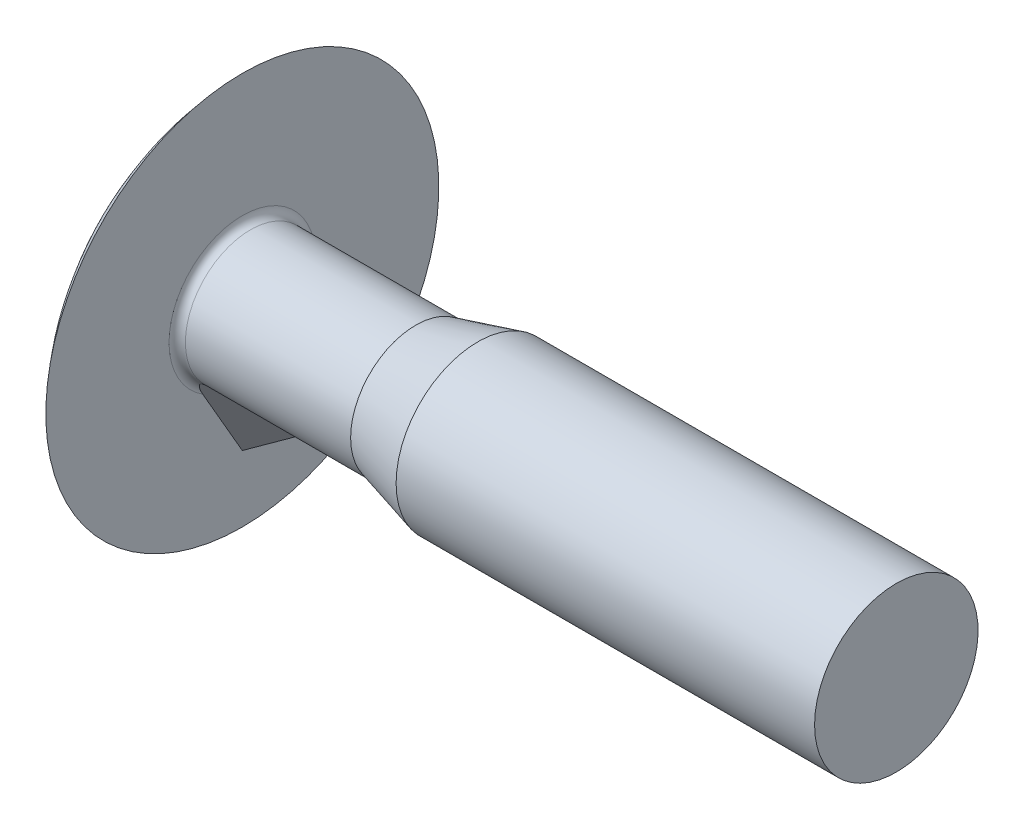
SolidWorks part; units mm, degrees
ref_plane "Front" through (0, 0, 0) normal (0, 0, 1) x (1, 0, 0)
ref_plane "Top" through (0, 0, 0) normal (0, 1, 0) x (1, 0, 0)
ref_plane "Right" through (0, 0, 0) normal (1, 0, 0) x (0, 0, -1)
sketch "Sketch1" plane through (-7.6906, 4.3277, 0) normal (0, 0, 1) x (0, 1, 0)
  line L0 (-4.3277, -12.2906) -> (-16.3461, -12.2906)
  line L1 (-4.3277, 1.3165) -> (-4.3277, -29.2605) construction
  line L2 (-4.3277, -12.2906) -> (-4.3277, -7.6906)
  arc A0 (-4.3277, -7.6906) -> (-16.3461, -12.2906) centre (-4.3277, -25.6906) ccw
  dimension "r" = 18
  dimension "k" = 4.6
revolve "BaseHead" add sketch "Sketch1" angle 360 about L1
sketch "Sketch2" plane through (4.6, 0, 0) normal (1, 0, 0) x (0, 0, -1)
  circle A0 centre (0, 0) radius 5
  dimension "d" = 10
extrude "BaseBody" add sketch "Sketch2" along normal blind 40
sketch "Sketch3" plane through (-15.8544, 0, 20.8544) normal (0, 1, 0) x (0, 0, -1)
  line L0 (20.8544, 6.1636) -> (20.8544, -42.8724) construction
  line L1 (25.8544, -34.8604) -> (24.8362, -31.0604)
  line L2 (20.8544, -60.4544) -> (20.8544, -20.4544) construction
  line L3 (24.8362, -31.0604) -> (24.8362, -20.4544)
  line L4 (25.8544, -60.4544) -> (25.8544, -20.4544) construction
  line L5 (24.8362, -20.4544) -> (25.8544, -20.4544)
  line L6 (25.8544, -20.4544) -> (25.8544, -34.8604)
  line L7 (15.8544, -20.4544) -> (25.8544, -20.4544) construction
  line L8 (8.8361, -20.4544) -> (32.8727, -20.4544) construction
  line L9 (15.8544, -60.4544) -> (25.8544, -60.4544) construction
  dimension "D1" = 15
  dimension "x" = 3.8
revolve "Cut-Revolve1" cut sketch "Sketch3" angle 360 about L0
fillet "Fillet1" radius 0.5 1 edges at (4.6, 0, 3.9818)
ref_plane "Plan1" through (10.1, 0, 0) normal (1, 0, 0) x (0, 0, -1)
sketch "Sketch4" plane through (4.6, 10.7187, 8.8426) normal (1, 0, 0) x (0, 0, 1)
  line L0 (-12.291, 12.7096) -> (-8.8426, 18.6823)
  line L1 (-8.8426, 18.6823) -> (-5.3943, 12.7096)
  line L2 (-12.291, 12.7096) -> (-5.3943, 12.7096)
  circle A0 centre (-8.8426, 10.7187) radius 3.9818 construction
  point P5 (-8.8426, 12.7096)
  dimension "D1" = 60
sketch "Sketch5" plane through (10.1, 0, 0) normal (1, 0, 0) x (0, 0, -1)
  line L0 (0, 0) -> (0, -9.3883) construction
  circle A0 centre (0, 0) radius 3.9818 construction
  circle A1 centre (0, 0) radius 3.9818 construction
  point P6 (0, -3.9818)
loft "Nib" add profiles "Sketch4", "Sketch5"
sketch "Sketch6" plane through (0, 0, 0) normal (0, 0, 1) x (1, 0, 0)
  line L0 (44.194, 5.2) -> (45.006, 5.2)
  line L1 (45.006, 5.2) -> (45.006, 5)
  line L2 (45.006, 5) -> (44.6, 4.2968)
  line L3 (44.194, 5) -> (44.6, 4.2968)
  line L4 (44.194, 5.2) -> (44.194, 5)
  line L5 (44.6, -5) -> (44.6, 5) construction
  line L6 (44.194, 5) -> (45.006, 5) construction
  line L7 (44.6, 5) -> (44.6, 4.2968) construction
  line L8 (44.6, 5) -> (19.006, 5) construction
  line L9 (0, 0) -> (56.0764, 0) construction
  point P5 (44.6, 5.2)
  dimension "D1" = 0.2
  dimension "D2" = 0.812
revolve "Cut-Revolve10" [suppressed] cut sketch "Sketch6" angle 360 about L9
pattern_linear "LPattern10" [suppressed] count 26 spacing 0.9744 along (1, 0, 0)
equation "\"D2@Sketch6\" = (  \"d@Sketch2\" - \"D2@ThreadCosmetic1\" )  / 2"
equation "\"D3@LPattern10\" = 1.2 * \"D2@Sketch6\""
equation "\"D1@LPattern10\" = \"b@ThreadCosmetic1\" / \"D3@LPattern10\""
